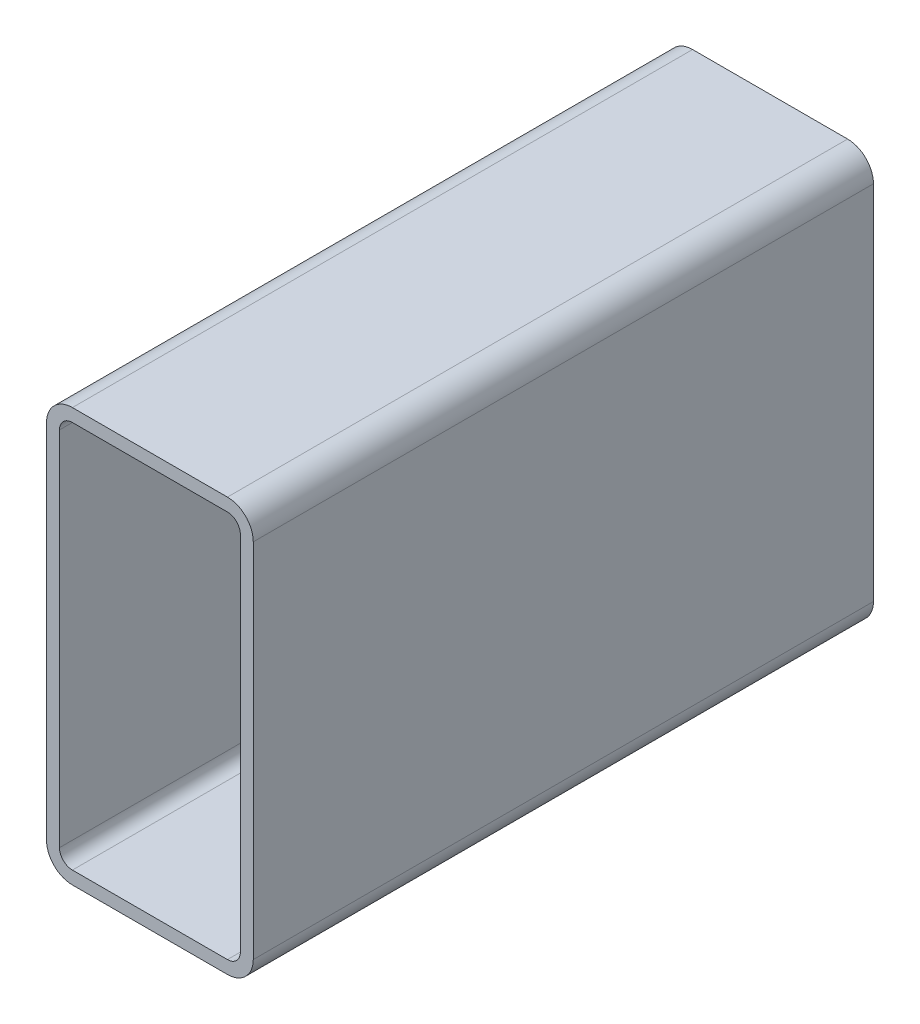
SolidWorks part; units mm, degrees
ref_plane "Front Plane" through (0, 0, 0) normal (0, 0, 1) x (1, 0, 0)
ref_plane "Top Plane" through (0, 0, 0) normal (0, 1, 0) x (1, 0, 0)
ref_plane "Right Plane" through (0, 0, 0) normal (1, 0, 0) x (0, 0, -1)
sketch "Sketch1" plane through (0, 0, 0) normal (0, 0, 1) x (1, 0, 0)
sketch_block_instance "HSS8x4x0.250-1"
sketch_block "HSS8x4x0.250"
extrude "Boss-Extrude1" add sketch "Sketch1" along normal blind 304.8
